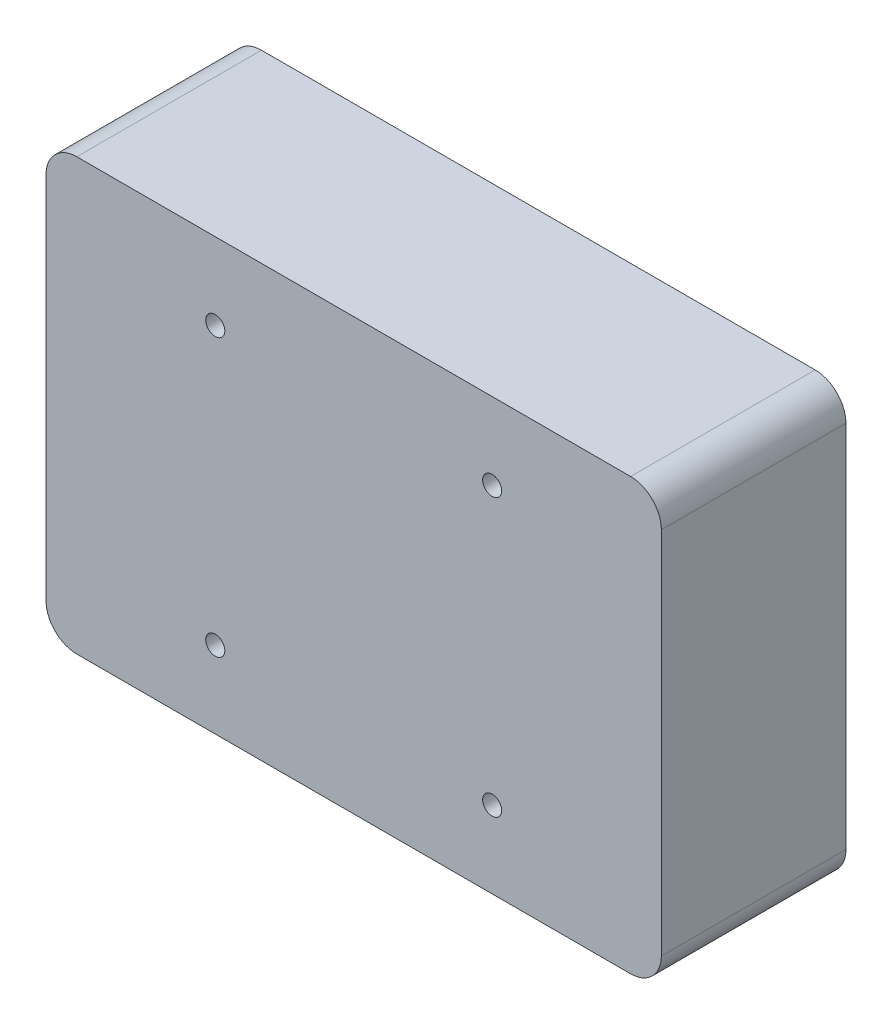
SolidWorks part; units mm, degrees
ref_plane "前视基准面" through (0, 0, 0) normal (0, 0, 1) x (1, 0, 0)
ref_plane "上视基准面" through (0, 0, 0) normal (0, 1, 0) x (1, 0, 0)
ref_plane "右视基准面" through (0, 0, 0) normal (1, 0, 0) x (0, 0, -1)
other "Configuration Table"
sketch "草图1" plane through (0, 0, 0) normal (0, 0, 1) x (1, 0, 0)
  line L1 (-50, 35) -> (50, 35)
  line L2 (-50, 35) -> (-50, -35)
  line L3 (-50, -35) -> (50, -35)
  line L4 (50, 35) -> (50, -35)
  line L5 (-50, 35) -> (50, -35) construction
  line L6 (-50, -35) -> (50, 35) construction
  line L7 (-22.5, 22.5) -> (22.5, 22.5) construction
  line L8 (-22.5, 22.5) -> (-22.5, -22.5) construction
  line L9 (-22.5, -22.5) -> (22.5, -22.5) construction
  line L10 (22.5, 22.5) -> (22.5, -22.5) construction
  line L11 (-22.5, 22.5) -> (22.5, -22.5) construction
  line L12 (-22.5, -22.5) -> (22.5, 22.5) construction
  circle A0 centre (-22.5, 22.5) radius 1.55
  circle A1 centre (-22.5, -22.5) radius 1.55
  circle A2 centre (22.5, -22.5) radius 1.55
  circle A3 centre (22.5, 22.5) radius 1.55
  point P0 (0, 0)
  point P6 (0, 0)
extrude "凸台-拉伸1" add sketch "草图1" along normal blind 30
fillet "圆角1" radius 5 4 edges at (50, 35, 15) (50, -35, 15) (-50, -35, 15) (-50, 35, 15)
